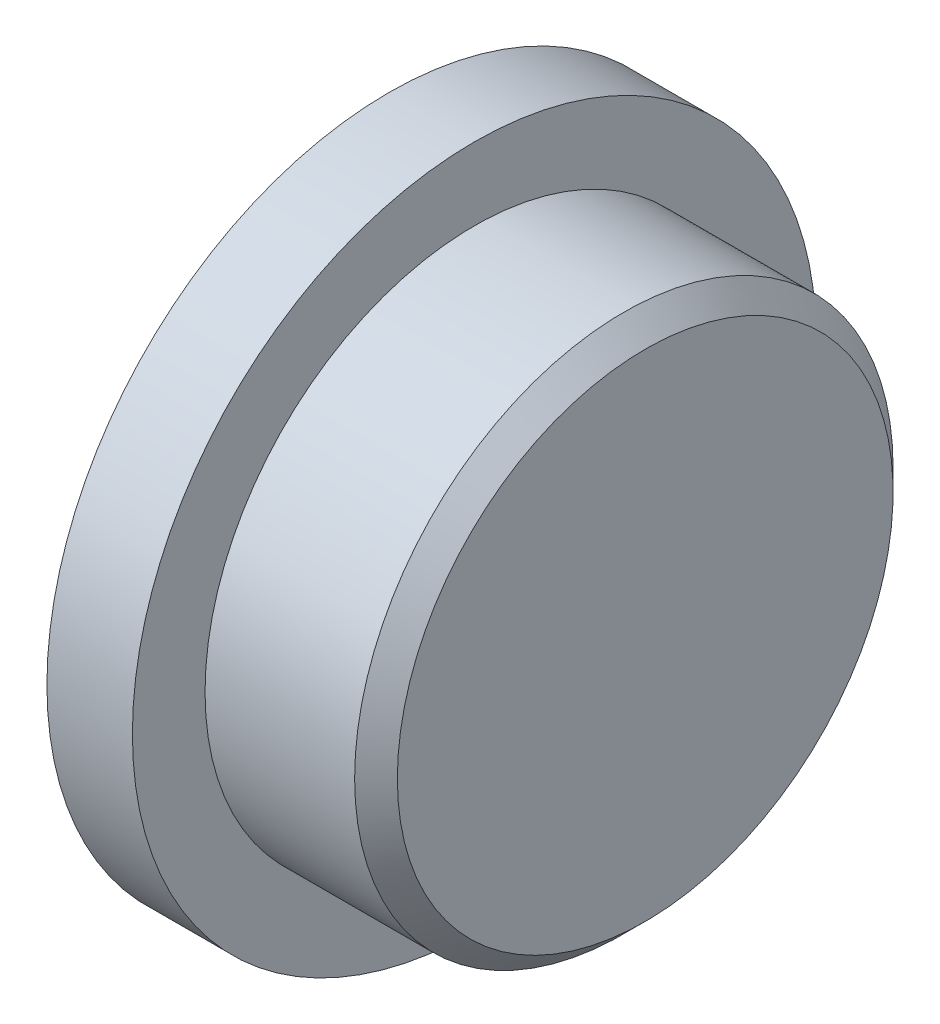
SolidWorks part; units mm, degrees
ref_plane "Front Plane" through (0, 0, 0) normal (0, 0, 1) x (1, 0, 0)
ref_plane "Top Plane" through (0, 0, 0) normal (0, 1, 0) x (1, 0, 0)
ref_plane "Right Plane" through (0, 0, 0) normal (1, 0, 0) x (0, 0, -1)
sketch "Sketch2" plane through (0, 0, 0) normal (0, 0, 1) x (1, 0, 0)
  line L0 (0, 0) -> (3, 0)
  line L1 (3, 0) -> (3, 3.15)
  line L2 (3, 3.15) -> (1, 3.15)
  line L3 (1, 3.15) -> (1, 4)
  line L4 (1, 4) -> (0, 4)
  line L5 (0, 4) -> (0, 0)
  dimension "D1" = 3.15
  dimension "D2" = 4
  dimension "D3" = 1
  dimension "D4" = 2
revolve "Revolve1" add sketch "Sketch2" angle 360 about L0
chamfer "Chamfer1" distance 0.25 angle 45 1 edges at (3, 0, 3.15)
